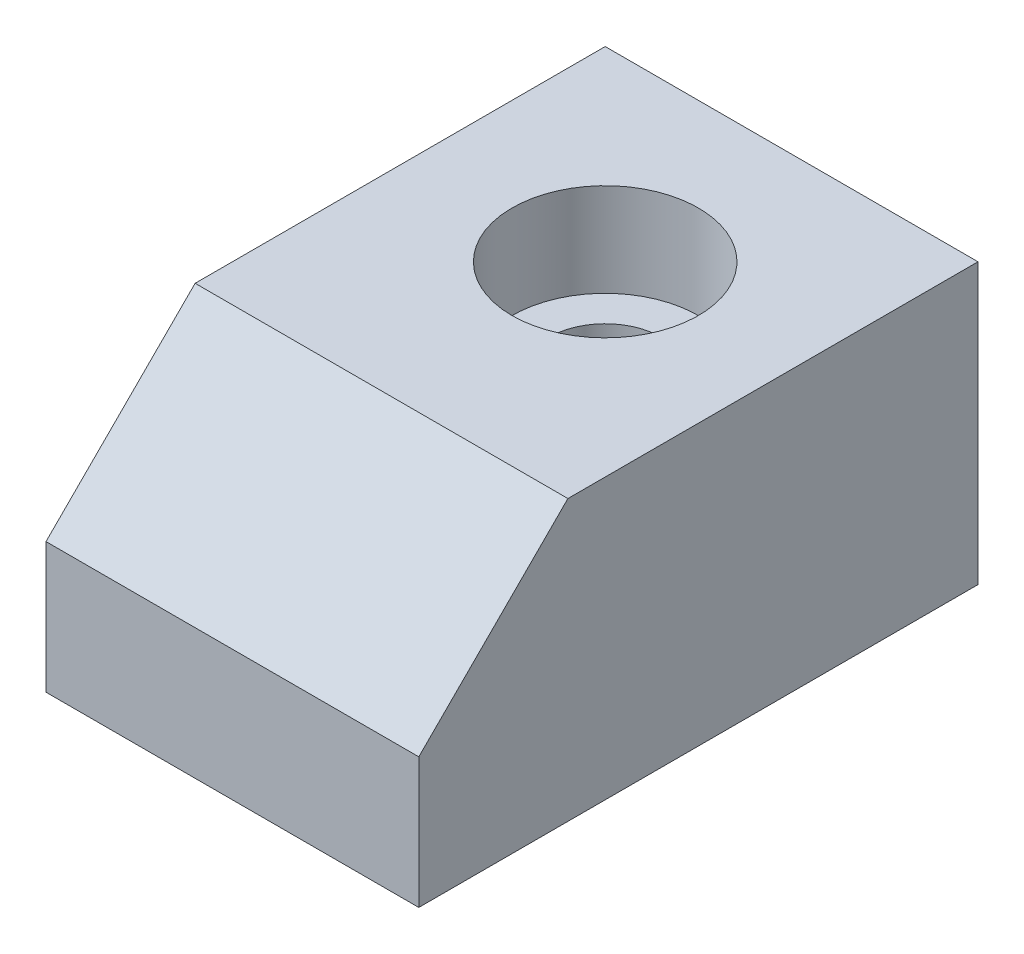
SolidWorks part; units mm, degrees
ref_plane "前视基准面" through (0, 0, 0) normal (0, 0, 1) x (1, 0, 0)
ref_plane "上视基准面" through (0, 0, 0) normal (0, 1, 0) x (1, 0, 0)
ref_plane "右视基准面" through (0, 0, 0) normal (1, 0, 0) x (0, 0, -1)
sketch "草图1" plane through (0, 0, 0) normal (1, 0, 0) x (0, 0, -1)
  line L1 (-15, -7.5) -> (15, -7.5)
  line L2 (-15, -7.5) -> (-15, 7.5)
  line L3 (-15, 7.5) -> (15, 7.5)
  line L4 (15, -7.5) -> (15, 7.5)
  line L5 (-15, -7.5) -> (15, 7.5) construction
  line L6 (-15, 7.5) -> (15, -7.5) construction
  point P0 (0, 0)
  dimension "D1" = 30
  dimension "D2" = 15
extrude "凸台-拉伸1" add sketch "草图1" along normal blind 20
ref_plane "基准面1" through (10, 0, 0) normal (1, 0, 0) x (0, 0, -1)
sketch "草图3" plane through (10, 0, 0) normal (1, 0, 0) x (0, 0, -1)
  line L0 (5, 10.1511) -> (5, -11.1683) construction
  line L1 (5, 7.5232) -> (0, 7.5)
  line L2 (15, 7.5) -> (-15, 7.5) construction
  line L3 (0, 7.5) -> (0, 2.5)
  line L4 (0, 2.5) -> (2, 2.5)
  line L5 (2, 2.5) -> (2, -7.5)
  line L6 (-15, -7.5) -> (15, -7.5) construction
  line L7 (2, -7.5) -> (5, -7.5)
  line L8 (5, -7.5) -> (5, 7.5232)
  dimension "D1" = 5
  dimension "D2" = 3
  dimension "D3" = 5
  dimension "D4" = 10
revolve "切除-旋转1" cut sketch "草图3" angle 360 about L0
sketch "草图4" plane through (20, 0, 0) normal (1, 0, 0) x (0, 0, -1)
  line L0 (-15, 7.5) -> (-15, -7.5) construction
  line L1 (-15, 7.5) -> (-15, -0.5)
  line L2 (-15, -0.5) -> (-7, 7.5)
  line L3 (15, 7.5) -> (-15, 7.5) construction
  line L4 (-7, 7.5) -> (-15, 7.5)
  dimension "D1" = 8
  dimension "D2" = 8
extrude "切除-拉伸1" cut sketch "草图4" against normal blind 20
